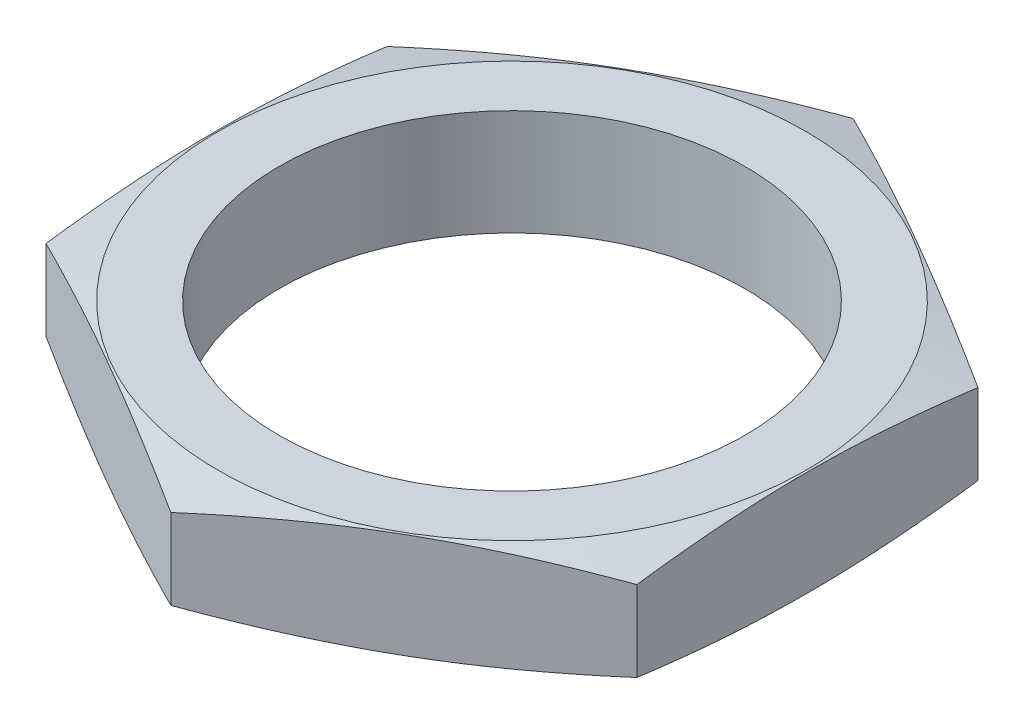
SolidWorks part; units mm, degrees
ref_plane "Plan de face" through (0, 0, 0) normal (0, 0, 1) x (1, 0, 0)
ref_plane "Plan de dessus" through (0, 0, 0) normal (0, 1, 0) x (1, 0, 0)
ref_plane "Plan de droite" through (0, 0, 0) normal (1, 0, 0) x (0, 0, -1)
sketch "Esquisse1" plane through (0, 0, 0) normal (0, 1, 0) x (1, 0, 0)
  line L1 (-6.975, -4.027) -> (0, -8.054)
  line L2 (0, -8.054) -> (6.975, -4.027)
  line L3 (6.975, -4.027) -> (6.975, 4.027)
  line L4 (6.975, 4.027) -> (0, 8.054)
  line L5 (0, 8.054) -> (-6.975, 4.027)
  line L6 (-6.975, 4.027) -> (-6.975, -4.027)
  circle A0 centre (0, 0) radius 6.975 construction
  dimension "D1" = 13.95
extrude "Boss.-Extru.1" add sketch "Esquisse1" along normal blind 2.5
hole_wizard "Trou taraudé M12x1.01" positions "Esquisse3" profile "Esquisse2" tap size "M12x1.0" standard "DIN"
sketch "Esquisse3" plane through (0, 2.5, 0) normal (0, 1, 0) x (1, 0, 0)
  point P0 (0, 0)
sketch "Esquisse2" plane through (0, 2.5, 0) normal (1, 0, 0) x (0, 0, 1)
  line L0 (0, 0) -> (0, 2.5)
  line L1 (0, 2.5) -> (5.5, 2.5)
  line L2 (5.5, 2.5) -> (5.5, 0)
  line L5 (5.5, 0) -> (0, 0)
  line L11 (0, -6.35) -> (0, 107.95) construction
  dimension "Diamètre du trou pour taraudage jusqu'au prochain" = 11
  dimension "Profondeur du trou pour taraudage jusqu'au prochain" = 2.5
sketch "Esquisse4" plane through (0, 0, 0) normal (1, 0, 0) x (0, 0, -1)
  line L0 (0, 0) -> (0, 1.25) construction
  line L1 (-8.054, 1.25) -> (0, 1.25) construction
  line L2 (-8.054, 2.5) -> (-8.054, 0) construction
  line L3 (-8.054, 2.5) -> (-8.054, 2.2)
  line L4 (-8.054, 2.2) -> (-6.9344, 2.5)
  line L5 (-8.054, 2.5) -> (-6.9344, 2.5)
  line L7 (-8.054, 2.5) -> (-4.027, 2.5) construction
  line L8 (-8.054, 0) -> (-6.9344, 0)
  line L9 (-8.054, 0.3) -> (-6.9344, 0)
  line L10 (-8.054, 0) -> (-8.054, 0.3)
  dimension "D1" = 15
  dimension "D2" = 0.3
revolve "Enlèvement de matière-Révolution1" cut sketch "Esquisse4" angle 360 about L0
